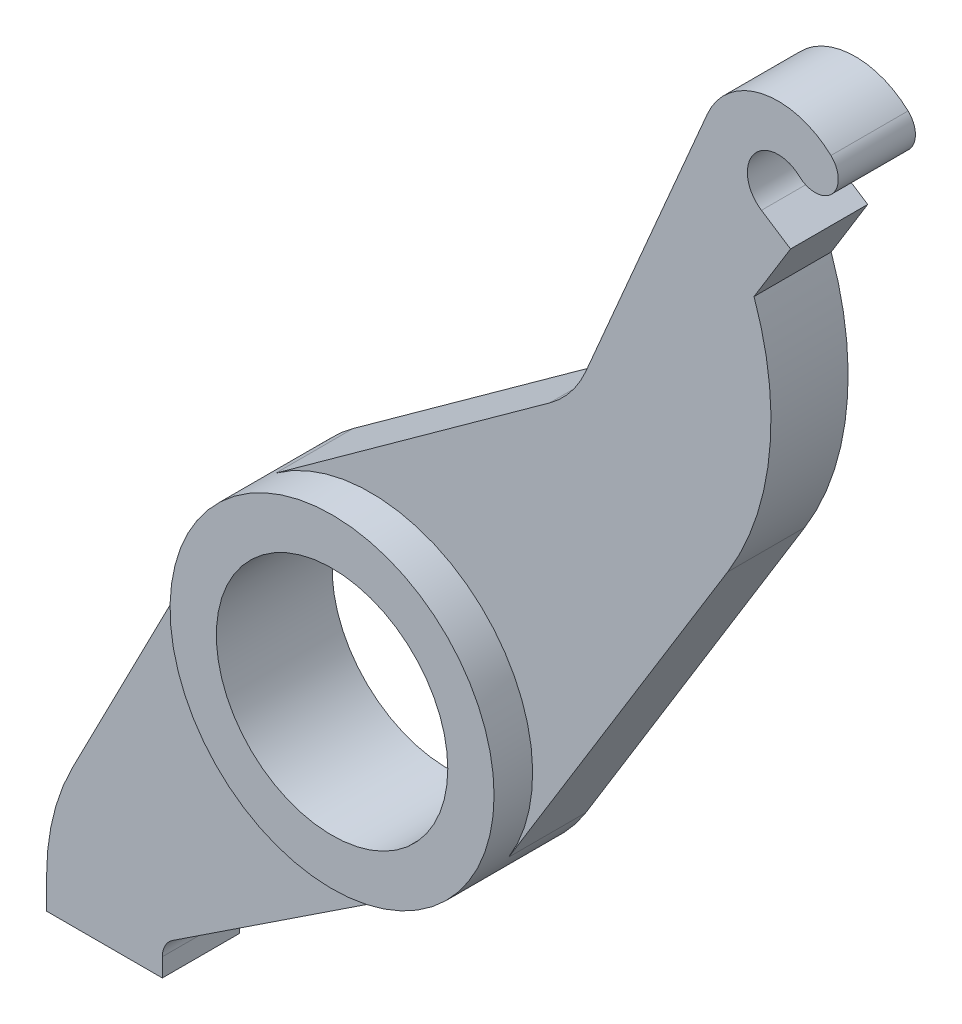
SolidWorks part; units mm, degrees
ref_plane "Plan de face" through (0, 0, 0) normal (0, 0, 1) x (1, 0, 0)
ref_plane "Plan de dessus" through (0, 0, 0) normal (0, 1, 0) x (1, 0, 0)
ref_plane "Plan de droite" through (0, 0, 0) normal (1, 0, 0) x (0, 0, -1)
sketch "Esquisse1" plane through (0, 0, 0) normal (0, 0, 1) x (1, 0, 0)
  line L0 (0, 74.8338) -> (0, -77.4544) construction
  line L1 (-83.9067, 0) -> (103.525, 0) construction
  line L2 (-18.6738, 9.6067) -> (-38.6769, -29.2762)
  line L3 (-42, -43) -> (-42, -47)
  line L4 (-42, -47) -> (-27, -47)
  line L5 (-27, -47) -> (-27, -44.6138)
  line L6 (-25.6534, -42.1106) -> (11.5735, -17.5229)
  line L7 (17.8947, -10.99) -> (46.2716, 35.2154)
  line L8 (0, 0) -> (67.8184, 104.4311) construction
  line L9 (49.6925, 67.8389) -> (54.4254, 75.5455)
  line L10 (54.4254, 75.5455) -> (50.6514, 77.9964)
  line L11 (54.4254, 75.5455) -> (68.1718, 97.9283) construction
  line L12 (43.6383, 85.2896) -> (27.8684, 48.486)
  line L13 (23.1954, 42.6494) -> (-12.2931, 17.0259)
  arc A0 (-12.2931, 17.0259) -> (-18.6738, 9.6067) centre (0, 0) ccw
  arc A1 (-38.6769, -29.2762) -> (-42, -43) centre (-12, -43) ccw
  arc A2 (46.2716, 35.2154) -> (49.6925, 67.8389) centre (13.8907, 55.102) ccw
  arc A3 (-27, -44.6138) -> (-25.6534, -42.1106) centre (-24, -44.6138) cw
  arc A4 (50.6514, 77.9964) -> (55.5618, 84.2729) centre (52.83, 81.351) cw
  arc A5 (55.5618, 84.2729) -> (59.6595, 88.6557) centre (57.6106, 86.4643) ccw
  arc A6 (59.6595, 88.6557) -> (43.6383, 85.2896) centre (52.83, 81.351) ccw
  arc A7 (27.8684, 48.486) -> (23.1954, 42.6494) centre (15, 54) cw
  arc A8 (11.5735, -17.5229) -> (17.8947, -10.99) centre (0, 0) ccw
  circle A9 centre (0, 0) radius 15
  point P21 (-27, -43)
  dimension "D1" = 42
  dimension "D5" = 30
  dimension "D6" = 3
  dimension "D11" = 38
  dimension "D12" = 4
  dimension "D13" = 3
  dimension "D15" = 10
  dimension "D16" = 14
  dimension "D20" = 30
  dimension "D2" = 4
  dimension "D3" = 4
  dimension "D4" = 15
  dimension "D7" = 27
  dimension "D8" = 47
  dimension "D9" = 123
  dimension "D10" = 25
  dimension "D14" = 4.5
  dimension "D17" = 15
  dimension "D18" = 54
  dimension "D19" = 97
extrude "Boss.-Extru.1" add sketch "Esquisse1" along normal blind 10
sketch "Esquisse2" plane through (0, 0, 10) normal (0, 0, 1) x (1, 0, 0)
  circle A0 centre (0, 0) radius 21
  circle A1 centre (0, 0) radius 15
extrude "Boss.-Extru.2" add sketch "Esquisse2" along normal blind 5
